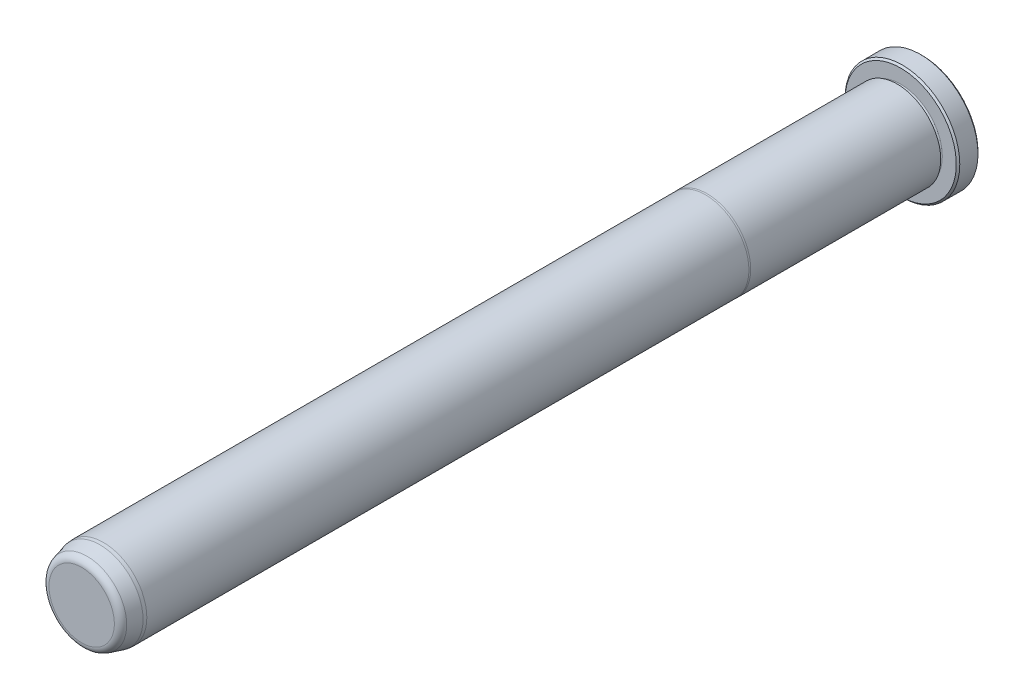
SolidWorks part; units mm, degrees
ref_plane "Front Plane" through (0, 0, 0) normal (0, 0, 1) x (1, 0, 0)
ref_plane "Top Plane" through (0, 0, 0) normal (0, 1, 0) x (1, 0, 0)
ref_plane "Right Plane" through (0, 0, 0) normal (1, 0, 0) x (0, 0, -1)
sketch "Sketch1" plane through (0, 0, 0) normal (1, 0, 0) x (0, 0, -1)
  line L0 (0, 0) -> (0, 12.573)
  line L1 (0, 12.573) -> (-4.7498, 12.573)
  line L2 (-4.7498, 12.573) -> (-4.7498, 9.1313)
  line L3 (-4.7498, 8.7503) -> (-5.5118, 8.7503) construction
  line L4 (-5.5118, 9.1313) -> (-5.5118, 9.5377)
  line L5 (-5.5118, 9.5377) -> (-47.1348, 9.5377)
  line L6 (-47.1348, 9.5377) -> (-47.498, 9.5123)
  line L7 (-47.498, 9.5123) -> (-179.3875, 9.5123)
  line L9 (-184.15, 8.3737) -> (-184.15, 0)
  line L10 (-184.15, 0) -> (0, 0)
  line L11 (0, 0) -> (13.6287, 0) construction
  line L12 (-179.3875, 9.5123) -> (-180.1495, 9.4456)
  line L13 (-180.1495, 9.4456) -> (-184.15, 8.3737)
  arc A0 (-5.5118, 9.1313) -> (-4.7498, 9.1313) centre (-5.1308, 9.1313) ccw
  dimension "D14" = 0.762
  dimension "D1" = 4.7498
  dimension "D2" = 0.762
  dimension "D3" = 25.146
  dimension "D4" = 19.0754
  dimension "D5" = 47.498
  dimension "D6" = 184.15
  dimension "D7" = 0.7874
  dimension "D8" = 4
  dimension "D9" = 19.0246
  dimension "D10" = 5
  dimension "D11" = 15
  dimension "D12" = 0.762
  dimension "D13" = 4.7625
revolve "Revolve1" add sketch "Sketch1" angle 360 about L11
fillet "Fillet6" radius 1.5875 1 edges at (8.3737, 0, 184.15)
chamfer "Chamfer1" distance 0.381 angle 45 2 edges at (12.573, 0, 0) (12.573, 0, 4.7498)
